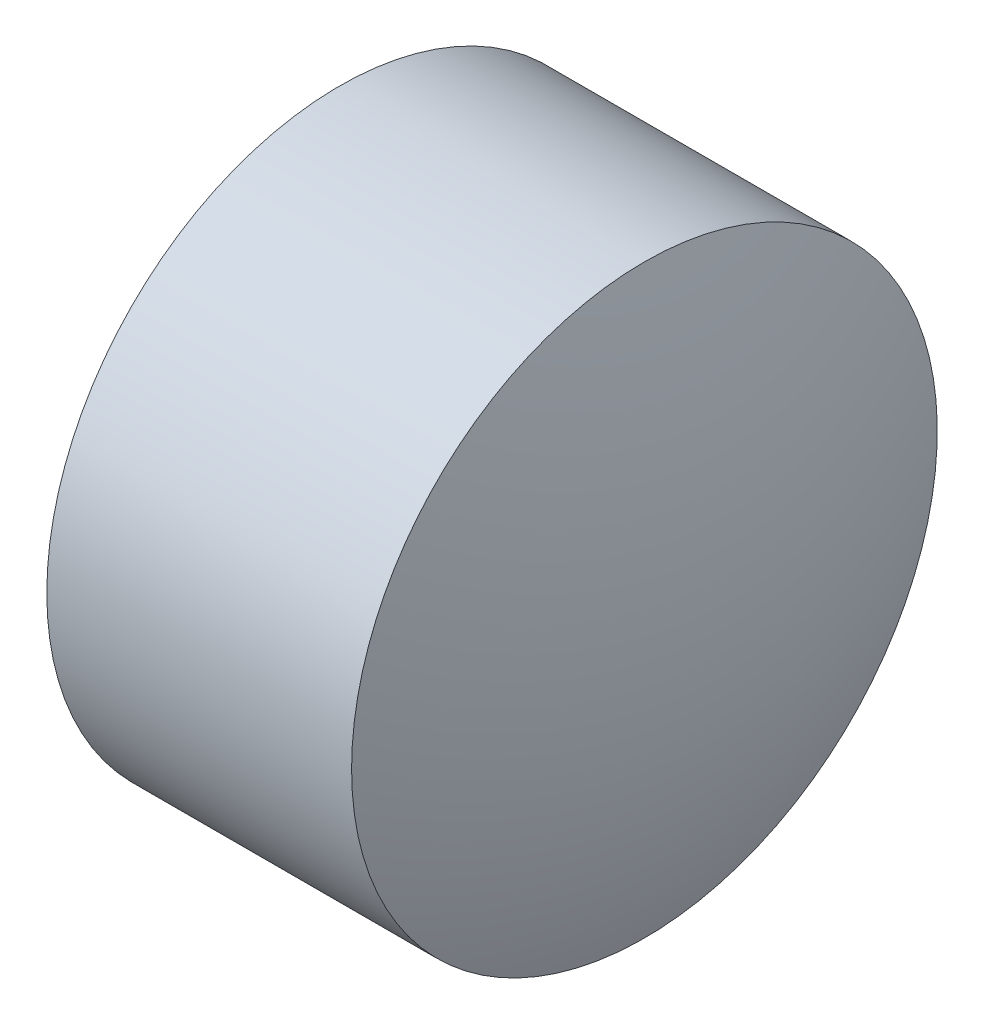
SolidWorks part; units mm, degrees
ref_plane "Front Plane" through (0, 0, 0) normal (0, 0, 1) x (1, 0, 0)
ref_plane "Top Plane" through (0, 0, 0) normal (0, 1, 0) x (1, 0, 0)
ref_plane "Right Plane" through (0, 0, 0) normal (1, 0, 0) x (0, 0, -1)
sketch "BodySke" plane through (0, 0, 0) normal (0, 0, 1) x (1, 0, 0)
  line L0 (0, 0) -> (3.28, 0) construction
  line L1 (2, 0) -> (2, 1.5) construction
  line L2 (1.723, 1.5) -> (1.723, 0) construction
  line L3 (2, 1.5) -> (0, 1.5) construction
  line L4 (0, 1.5) -> (0, 0)
  line L5 (0, 0) -> (2, 0)
  line L6 (1.5, 3.0647) -> (1.5, -0.3929) construction
  line L7 (0, 1.5) -> (1.723, 1.5)
  arc A0 (2, 0) -> (1.723, 1.5) centre (-2.2, 0) ccw
  point P5 (0, 1.2195)
  dimension "Oval_Radius" = 4.2
  dimension "Diameter" = 3
  dimension "Length" = 2
  dimension "Minor_dia" = 2.439
  dimension "Advance" = 0.5
revolve "BaseBody" add sketch "BodySke" angle 360 about L0
sketch "HeadChamferSke" plane through (0, 0, 0) normal (0, 0, 1) x (1, 0, 0)
  line L0 (0, 0) -> (2.4505, 0) construction
  line L1 (0, 1.5) -> (0, 1.2195)
  line L2 (0, 1.5) -> (0.1619, 1.5)
  line L3 (0.1619, 1.5) -> (0, 1.2195)
  line L6 (0, 1.5) -> (0, 0) construction
  line L7 (1.723, 1.5) -> (0, 1.5) construction
  dimension "Angle" = 30
revolve "HeadChamfer" cut sketch "HeadChamferSke" angle 360 about L0
sketch "HexagonSocketSke" plane through (0, 0, 0) normal (-1, 0, 0) x (0, 0, 1)
  line L1 (0, 0.866) -> (-0.75, 0.433)
  line L2 (-0.75, 0.433) -> (-0.75, -0.433)
  line L3 (-0.75, -0.433) -> (0, -0.866)
  line L4 (0, -0.866) -> (0.75, -0.433)
  line L5 (0.75, -0.433) -> (0.75, 0.433)
  line L6 (0.75, 0.433) -> (0, 0.866)
  circle A0 centre (0, 0) radius 0.75 construction
  dimension "Hexagon_Width" = 1.5
extrude "HexagonSocket" cut sketch "HexagonSocketSke" against normal blind 1.2
sketch "ThdSchSke" plane through (0, 0, 0) normal (0, 0, 1) x (1, 0, 0)
  line L0 (0, 0) -> (2.6881, 0) construction
  line L1 (0.3381, 1.8239) -> (0.3381, 1.5)
  line L2 (0.3381, 1.8239) -> (0.6619, 1.8239)
  line L3 (0.6619, 1.8239) -> (0.6619, 1.5)
  line L4 (0.6619, 1.5) -> (0.5, 1.2195)
  line L5 (0.5, 1.2195) -> (0.3381, 1.5)
  line L7 (0, 1.5) -> (1.723, 1.5) construction
  dimension "D1" = 0.5
revolve "ThreadSchematic" [suppressed] cut sketch "ThdSchSke" angle 360 about L0
pattern_linear "ThdSchPat" [suppressed] count 3 along (1, 0, 0)
equation "\"Minor_dia@ThreadCosmetic\" = \"Minor_dia@BodySke\""
equation "\"D1@ThdSchSke\" = \"Advance@BodySke\""
equation "\"Advance@ThdSchPat\" = \"Advance@BodySke\""
equation "\"D1@ThdSchPat\" =  int(\"Length@BodySke\" / \"Advance@BodySke\"  )  - 1"
